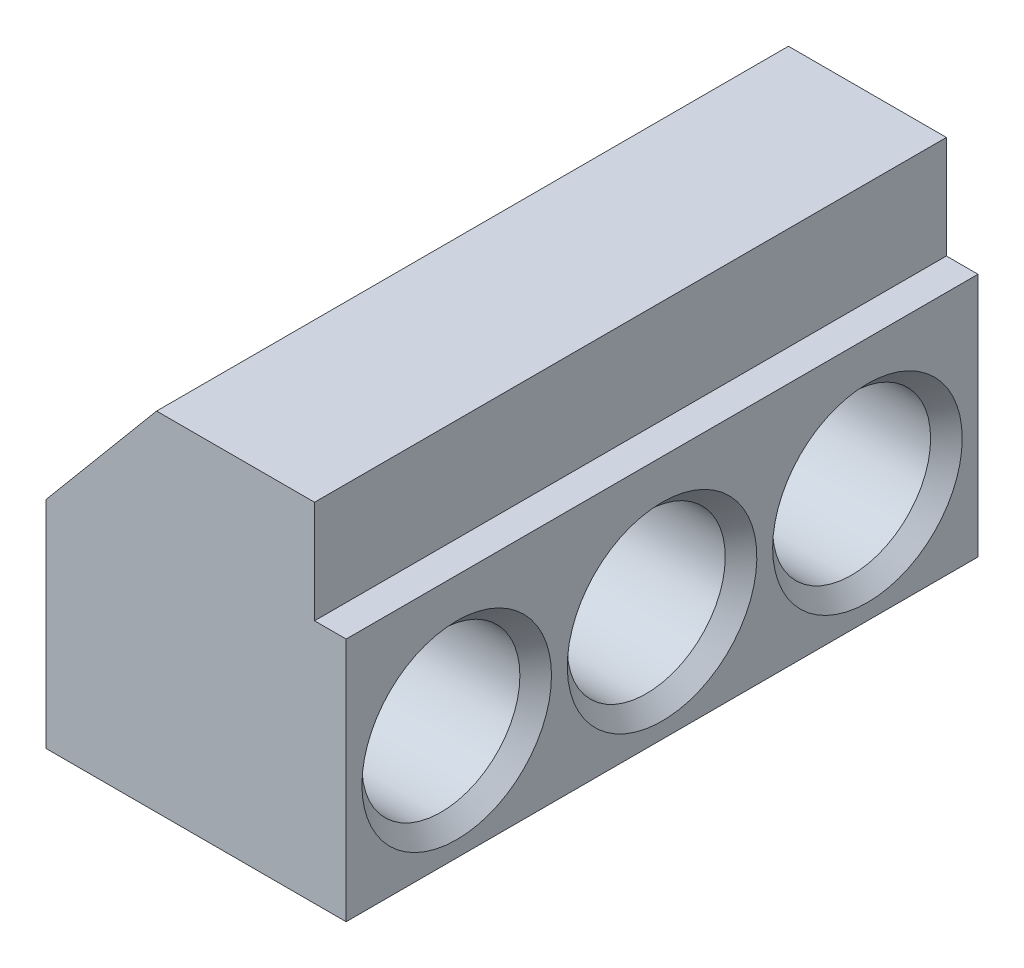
SolidWorks part; units mm, degrees
ref_plane "Face" through (0, 0, 0) normal (0, 0, 1) x (1, 0, 0)
ref_plane "Dessus" through (0, 0, 0) normal (0, 1, 0) x (1, 0, 0)
ref_plane "Droite" through (0, 0, 0) normal (1, 0, 0) x (0, 0, -1)
sketch "Esquisse1" plane through (0, 0, 0) normal (0, 0, 1) x (1, 0, 0)
  line L1 (0, 0) -> (19, 0)
  line L2 (0, 0) -> (0, 13.65)
  line L3 (7, 22) -> (19, 22)
  line L4 (19, 0) -> (19, 22)
  line L6 (7, 22) -> (0, 13.65)
extrude "Base-Extrusion" add sketch "Esquisse1" against normal blind 40
sketch "Esquisse2" plane through (0, 0, 0) normal (0, 0, 1) x (1, 0, 0)
  line L0 (19, 22) -> (7, 22) construction
  line L1 (17, 22) -> (19, 22)
  line L2 (17, 22) -> (17, 15.5)
  line L3 (17, 15.5) -> (19, 15.5)
  line L4 (19, 22) -> (19, 15.5)
  line L5 (19, 0) -> (19, 22) construction
  dimension "D1" = 2
  dimension "D2" = 6.5
extrude "Enlèv. mat.-Extru.1" cut sketch "Esquisse2" against normal through all
sketch "Esquisse3" plane through (19, 0, 0) normal (1, 0, 0) x (0, 0, -1)
  line L1 (0, 0) -> (0, 15.5) construction
  line L2 (40, 0) -> (0, 0) construction
  circle A0 centre (7, 7) radius 5
  circle A1 centre (33, 7) radius 5
  dimension "D1" = 10
  dimension "D2" = 10
  dimension "D3" = 26
  dimension "D4" = 7
  dimension "D5" = 7
extrude "Enlèv. mat.-Extru.2" cut sketch "Esquisse3" against normal through all
chamfer "Chanfrein1" distance 1 angle 45 4 edges at (0, 12, -7) (19, 12, -7) (0, 12, -33) (19, 12, -33)
sketch "Esquisse5" plane through (19, 0, 0) normal (1, 0, 0) x (0, 0, -1)
  line L0 (0, 0) -> (0, 15.5) construction
  line L1 (40, 0) -> (0, 0) construction
  circle A0 centre (20, 7) radius 5
  dimension "D1" = 20
  dimension "D2" = 7
extrude "Enlèv. mat.-Extru.3" cut sketch "Esquisse5" against normal blind 10
sketch "Esquisse6" plane through (9, 0, 0) normal (1, 0, 0) x (0, 0, -1)
  circle A0 centre (20, 7) radius 3
extrude "Enlèv. mat.-Extru.4" cut sketch "Esquisse6" against normal through all
chamfer "Chanfrein2" distance 1 angle 45 1 edges at (19, 12, -20)
chamfer "Chanfrein3" distance 0.5 angle 45 1 edges at (0, 10, -20)
